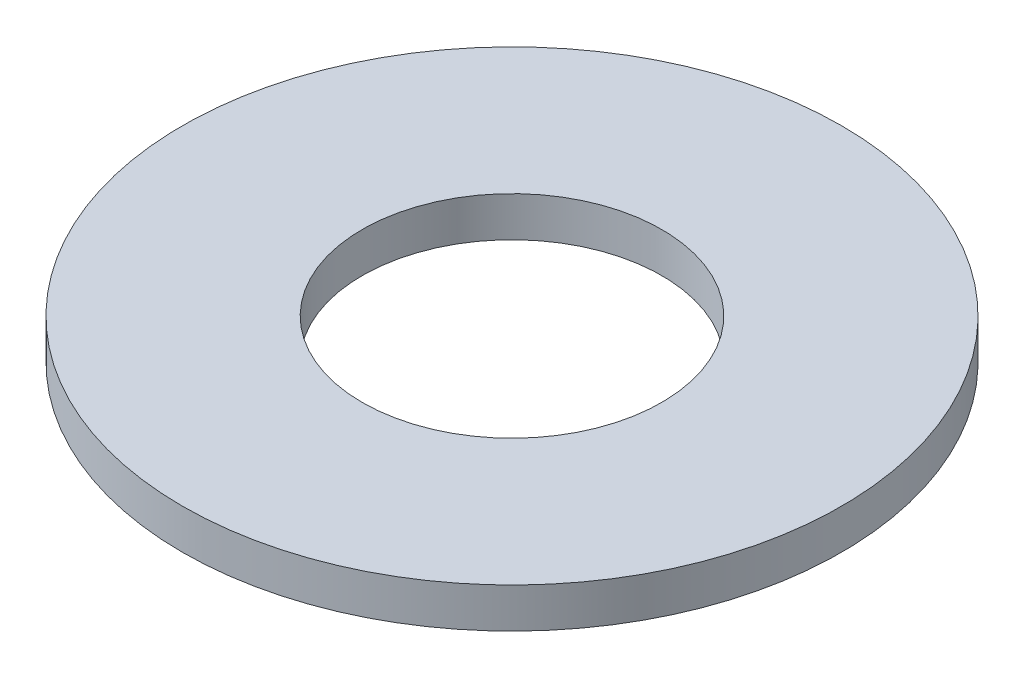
SolidWorks part; units mm, degrees
ref_plane "Front Plane" through (0, 0, 0) normal (0, 0, 1) x (1, 0, 0)
ref_plane "Top Plane" through (0, 0, 0) normal (0, 1, 0) x (1, 0, 0)
ref_plane "Right Plane" through (0, 0, 0) normal (1, 0, 0) x (0, 0, -1)
sketch "Sketch1" plane through (0, 0, 0) normal (0, 1, 0) x (1, 0, 0)
  circle A0 centre (0, 0) radius 82.5
  circle A1 centre (0, 0) radius 37.5
  dimension "D1" = 165
  dimension "D2" = 75
extrude "Boss-Extrude1" add sketch "Sketch1" along normal blind 10
